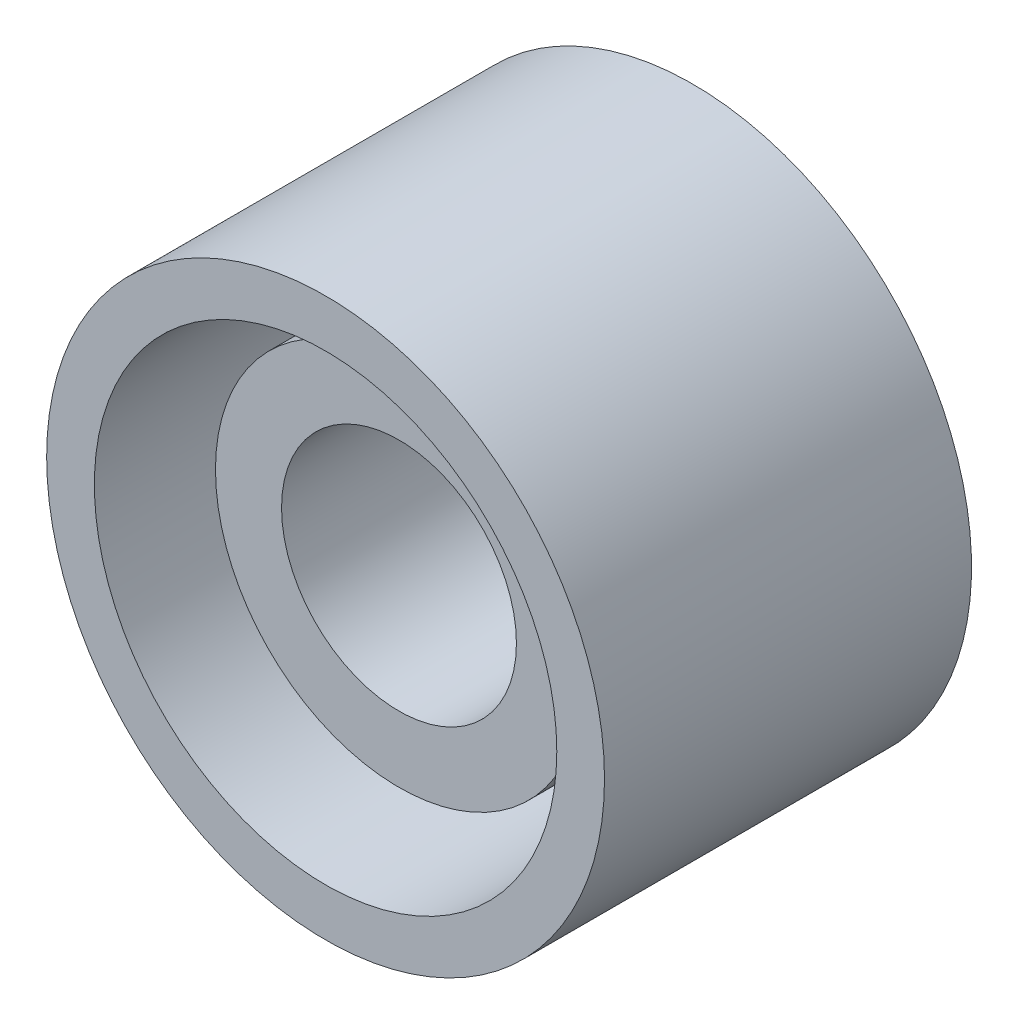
SolidWorks part; units mm, degrees
ref_plane "前视基准面" through (0, 0, 0) normal (0, 0, 1) x (1, 0, 0)
ref_plane "上视基准面" through (0, 0, 0) normal (0, 1, 0) x (1, 0, 0)
ref_plane "右视基准面" through (0, 0, 0) normal (1, 0, 0) x (0, 0, -1)
sketch "草图1" plane through (0, 0, 0) normal (0, 0, 1) x (1, 0, 0)
  circle A0 centre (0, 0) radius 31.5
  circle A1 centre (0, 0) radius 38
  dimension "D1" = 63
  dimension "D2" = 76
extrude "拉伸1" add sketch "草图1" along normal blind 30
sketch "草图2" plane through (0, 0, 0) normal (0, 0, -1) x (-1, 0, 0)
  circle A0 centre (0, 0) radius 25
  dimension "D1" = 50
extrude "拉伸2" add sketch "草图2" against normal blind 20
sketch "草图3" plane through (0, 0, 0) normal (0, 0, -1) x (-1, 0, 0)
  circle A0 centre (0, 0) radius 38
  dimension "D1" = 76
extrude "拉伸3" add sketch "草图3" along normal blind 20
sketch "草图4" plane through (0, 0, -20) normal (0, 0, -1) x (-1, 0, 0)
  circle A0 centre (0, 0) radius 16
  dimension "D1" = 32
extrude "切除-拉伸1" cut sketch "草图4" against normal through all
